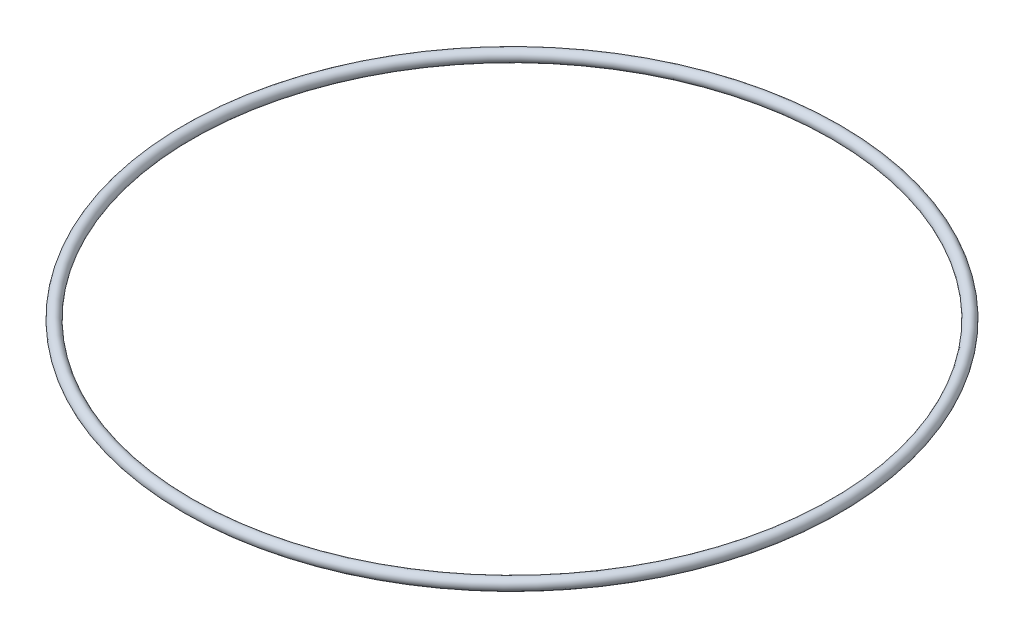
SolidWorks part; units mm, degrees
ref_plane "Front Plane" through (0, 0, 0) normal (0, 0, 1) x (1, 0, 0)
ref_plane "Top Plane" through (0, 0, 0) normal (0, 1, 0) x (1, 0, 0)
ref_plane "Right Plane" through (0, 0, 0) normal (1, 0, 0) x (0, 0, -1)
sketch "Sketch1" plane through (0, 0, 0) normal (0, 0, 1) x (1, 0, 0)
  line L0 (-85, 34.1419) -> (-85, -36.7052) construction
  circle A0 centre (0, 0) radius 1.5
  point P5 (-85, -36.7052)
  point P6 (-85, 34.1419)
  dimension "D1" = 3
  dimension "D2" = 85
revolve "Ring" add sketch "Sketch1" angle 360 about L0
sketch "Reference" plane through (0, 0, 0) normal (0, 1, 0) x (1, 0, 0)
  line L0 (-85, 83.5) -> (-85, -83.5) construction
  line L1 (-168.5, 0) -> (-1.5, 0) construction
  circle A0 centre (-85, 0) radius 83.5 construction
sketch "Reference 2" plane through (0, 0, 0) normal (0, 0, 1) x (1, 0, 0)
  line L0 (-85, 0) -> (-85, 39.959) construction
  line L1 (-168.5, 0) -> (-1.5, 0) construction
  line L2 (-85, 0) -> (-85, -39.959) construction
